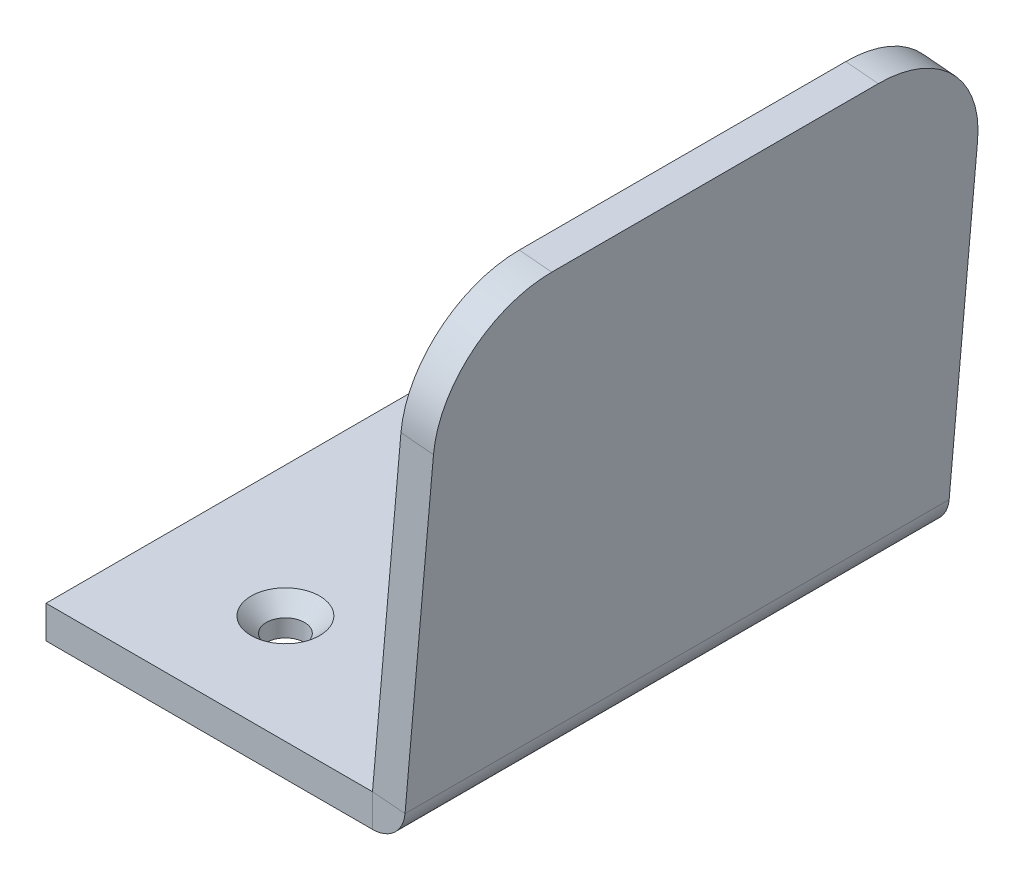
SolidWorks part; units mm, degrees
ref_plane "Front Plane" through (0, 0, 0) normal (0, 0, 1) x (1, 0, 0)
ref_plane "Top Plane" through (0, 0, 0) normal (0, 1, 0) x (1, 0, 0)
ref_plane "Right Plane" through (0, 0, 0) normal (1, 0, 0) x (0, 0, -1)
sketch "Sketch1" plane through (0, 0, 0) normal (0, 1, 0) x (1, 0, 0)
  line L1 (0, 0) -> (60, 0)
  line L2 (0, 0) -> (0, 50)
  line L3 (0, 50) -> (60, 50)
  line L4 (70, 10) -> (70, 40)
  arc A0 (70, 40) -> (60, 50) centre (60, 40) ccw
  arc A1 (60, 0) -> (70, 10) centre (60, 10) ccw
  point P7 (70, 50)
  dimension "D3" = 10
  dimension "D1" = 50
  dimension "D2" = 70
sheet metal parameters "Sheet-Metal1" thickness 3 parameters "D1"=1
base flange "Base-Flange1" sketch "Sketch1" thickness 3 reverse thickness direction yes parameters "D1"=1
sketch "Sketch3" plane through (0, 3, 0) normal (0, 1, 0) x (1, 0, 0)
  line L0 (12, 50) -> (12, 0) construction
  line L1 (60, 50) -> (0, 50) construction
  line L2 (0, 0) -> (60, 0) construction
  line L3 (0, 50) -> (0, 0) construction
  point P6 (12, 40)
  point P7 (12, 10)
  dimension "D1" = 12
  dimension "D2" = 10
  dimension "D3" = 10
hole_wizard "CSK for M3 Countersunk Flat Head Screw1" positions "3DSketch1" profile "Sketch4" countersink size "M3" standard "ISO"
sketch3d "3DSketch1"
  point P0 (12, 3, -40)
  point P3 (12, 3, -10)
sketch "Sketch4" plane through (12, 3, -40) normal (1, 0, 0) x (0, 0, 1)
  line L0 (0, 0) -> (0, 3)
  line L1 (0, 3) -> (1.75, 3)
  line L2 (1.75, 3) -> (1.75, 1.4)
  line L3 (1.75, 1.4) -> (3.15, 0)
  line L5 (3.15, 0) -> (0, 0)
  line L6 (-1.75, 1.4) -> (-3.15, 0) construction
  line L11 (0, -6.35) -> (0, 107.95) construction
  dimension "Thru Hole Dia." = 3.5
  dimension "Thru Hole Depth" = 3
  dimension "Near C'Sink Dia." = 6.3
  dimension "Near C'Sink Angle" = 90
sketch "Sketch5" plane through (0, 3, 0) normal (0, 1, 0) x (1, 0, 0)
  line L0 (30, 50) -> (30, 0)
  line L1 (60, 50) -> (0, 50) construction
  line L2 (0, 0) -> (60, 0) construction
  line L3 (0, 50) -> (0, 0) construction
  dimension "D1" = 30
sketched bend "Sketched Bend1" parameters "D1"=0.01
bend "SketchBend1" bend radius 0.01 bend angle 85 parameters "D5"=1
flat pattern "Flat-Pattern1"
sketch "Bend-Lines1" plane through (0, 0, 0) normal (0, 1, 0) x (-1, 0, 0)
bend of the flat pattern "Flatten-<SketchBend1>1"
